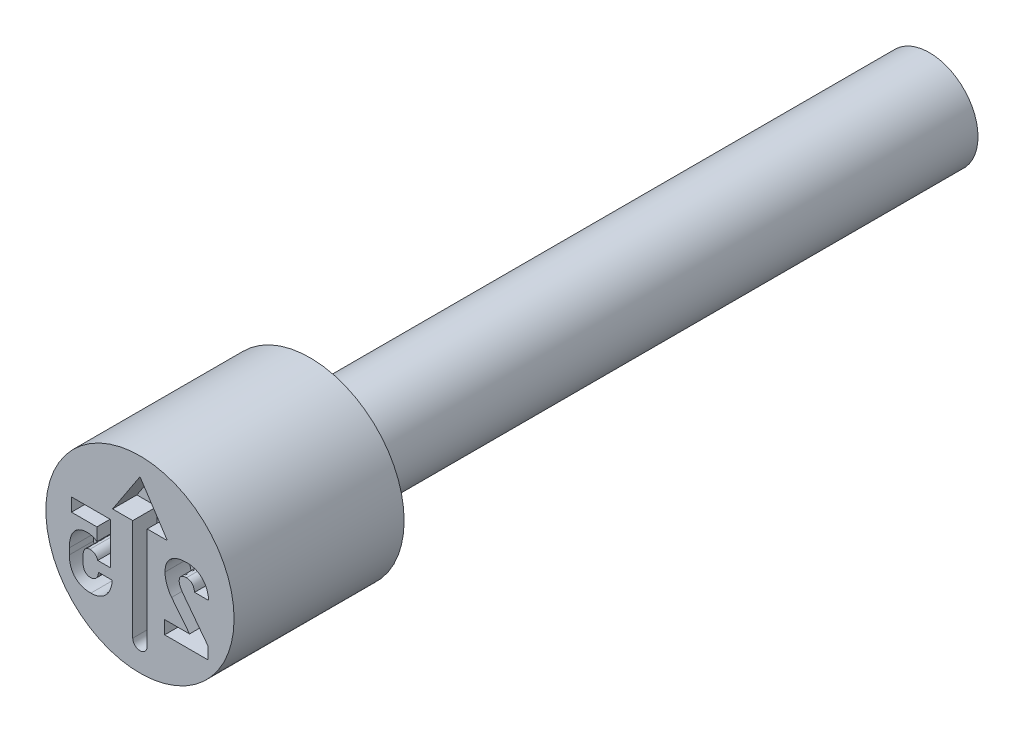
SolidWorks part; units mm, degrees
ref_plane "Front Plane" through (0, 0, 0) normal (0, 0, 1) x (1, 0, 0)
ref_plane "Top Plane" through (0, 0, 0) normal (0, 1, 0) x (1, 0, 0)
ref_plane "Right Plane" through (0, 0, 0) normal (1, 0, 0) x (0, 0, -1)
sketch "Sketch2" plane through (0, 0, 0) normal (1, 0, 0) x (0, 0, -1)
  line L0 (0.4039, 0) -> (50000.4039, 0) construction
  line L6 (0, 1.55) -> (0, 0)
  line L7 (2.8, 1.55) -> (0, 1.55)
  line L8 (2.8, 0.8) -> (2.8, 1.55)
  line L9 (13, 0.8) -> (2.8, 0.8)
  line L10 (13, 0) -> (13, 0.8)
  line L11 (0, 0) -> (13, 0)
  dimension "D1" = 3.1
  dimension "D2" = 1.6
  dimension "D3" = 13
  dimension "D4" = 2.8
revolve "Revolve1" add sketch "Sketch2" angle 360 about L0
sketch "Sketch3" plane through (0, 0, 0) normal (0, 0, 1) x (1, 0, 0)
  line L0 (0, 0) -> (0, 62500) construction
  line L1 (0.119, 0.5665) -> (0.119, -1.1101)
  line L2 (0.4512, 0.5665) -> (0.119, 0.5665)
  line L3 (0, 1.2513) -> (0.4512, 0.5665)
  line L15 (0, 1.2513) -> (-0.4512, 0.5665)
  line L16 (-0.4512, 0.5665) -> (-0.119, 0.5665)
  line L17 (-0.119, 0.5665) -> (-0.119, -1.1101)
  arc A2 (-0.119, -1.1101) -> (0.119, -1.1101) centre (0, -1.1101) ccw
extrude "Cut-Extrude4" cut sketch "Sketch3" against normal blind 0.4
sketch "Sketch4" plane through (0, 0, 0) normal (0, 0, 1) x (1, 0, 0)
  text T0 "2  5" font "Bahnschrift" height 1.2
  dimension "D1" = 0.8
extrude "Cut-Extrude5" cut sketch "Sketch4" against normal blind 0.4
